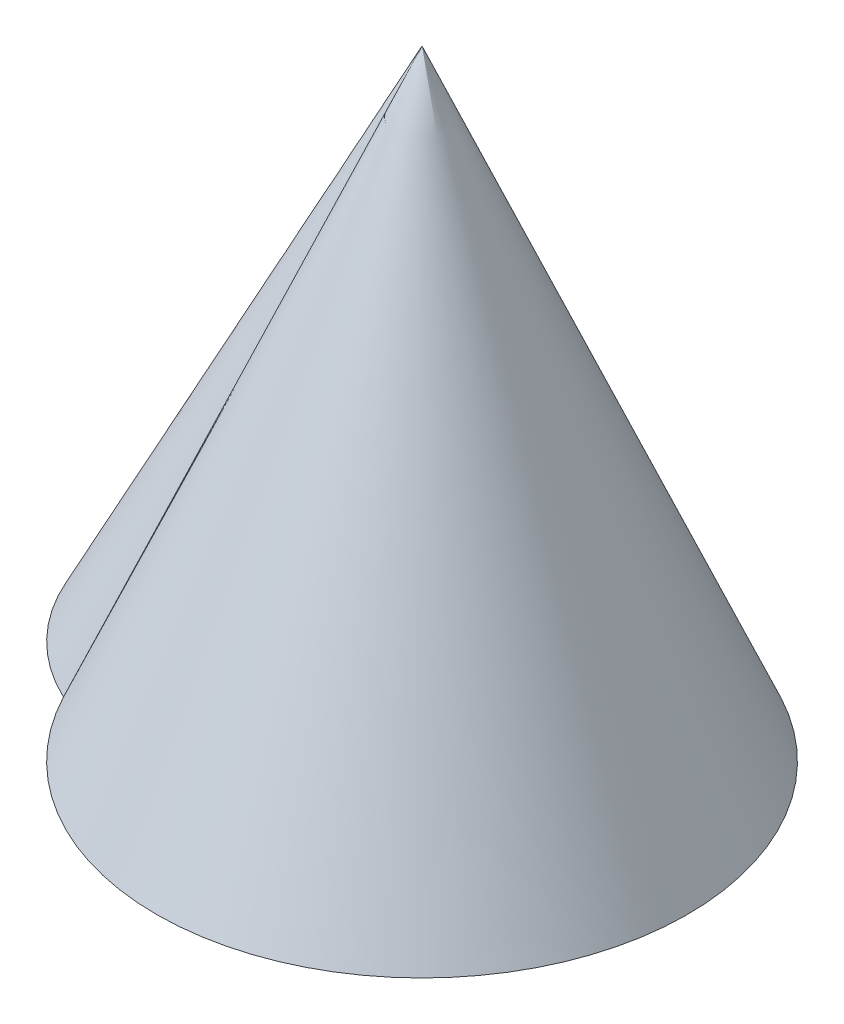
SolidWorks part; units mm, degrees
ref_plane "前视基准面" through (0, 0, 0) normal (0, 0, 1) x (1, 0, 0)
ref_plane "上视基准面" through (0, 0, 0) normal (0, 1, 0) x (1, 0, 0)
ref_plane "右视基准面" through (0, 0, 0) normal (1, 0, 0) x (0, 0, -1)
sketch "草图1" plane through (0, 0, 0) normal (0, 1, 0) x (1, 0, 0)
  arc A0 (-26.5465, -13.9743) -> (-10.74, 28.0116) centre (0, 0) ccw
  arc A1 (-10.74, 28.0116) -> (-26.5465, -13.9743) centre (-17, 6.4) ccw
  point P5 (-17.3515, 6.4097)
  dimension "D1" = 60
  dimension "D2" = 45
  dimension "D3" = 6.4
  dimension "D4" = 17
sketch "草图2" plane through (0, 0, 0) normal (1, 0, 0) x (0, 0, -1)
  line L0 (28.9, 0) -> (-13.9743, 0) construction
  point P0 (0, 70)
  dimension "D1" = 70
loft "放样1" add profiles "草图2", "草图1"
